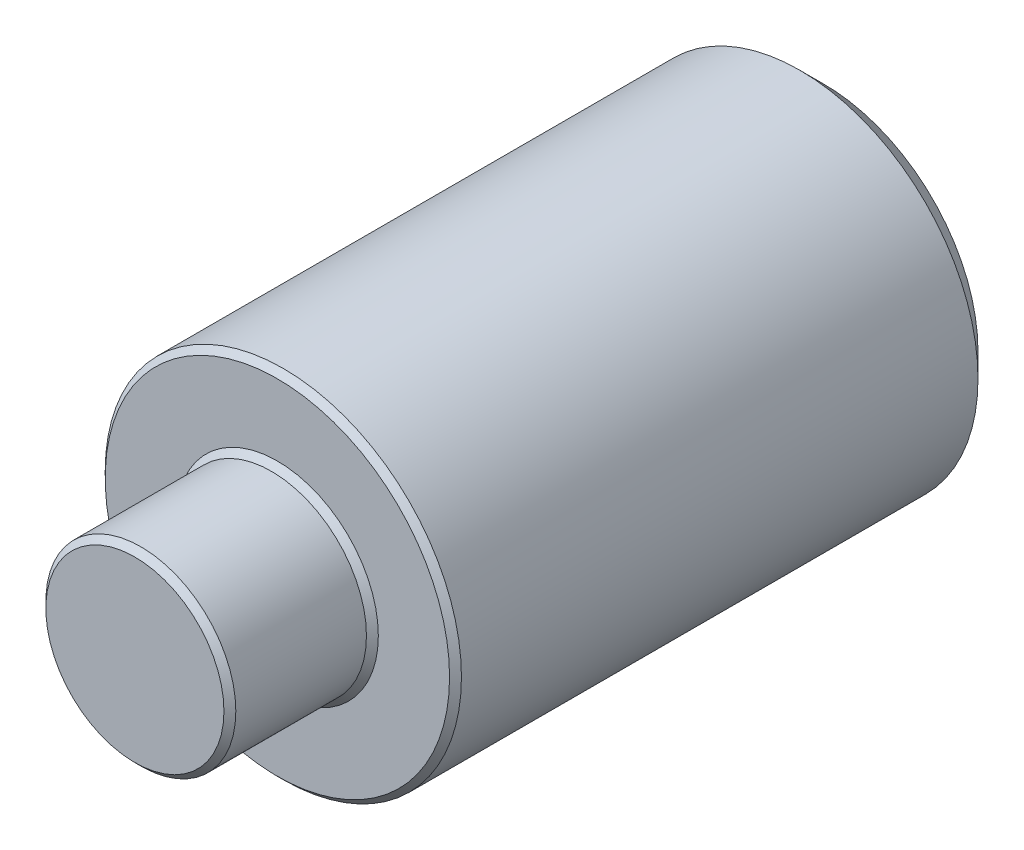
SolidWorks part; units mm, degrees
ref_plane "Спереди" through (0, 0, 0) normal (0, 0, 1) x (1, 0, 0)
ref_plane "Сверху" through (0, 0, 0) normal (0, 1, 0) x (1, 0, 0)
ref_plane "Справа" through (0, 0, 0) normal (1, 0, 0) x (0, 0, -1)
sketch "Эскиз1" plane through (0, 0, 0) normal (0, 0, 1) x (1, 0, 0)
  circle A0 centre (0, 0) radius 7.5
  dimension "D1" = 15
extrude "Бобышка-Вытянуть1" add sketch "Эскиз1" along normal blind 23
sketch "Эскиз2" plane through (0, 0, 23) normal (0, 0, 1) x (1, 0, 0)
  circle A0 centre (0, 0) radius 4
  dimension "D1" = 8
extrude "Бобышка-Вытянуть2" add sketch "Эскиз2" along normal blind 6
chamfer "Фаска1" distance 1 angle 45 1 edges at (7.5, 0, 0)
chamfer "Фаска2" distance 0.25 angle 45 3 edges at (4, 0, 29) (4, 0, 23) (7.5, 0, 23)
